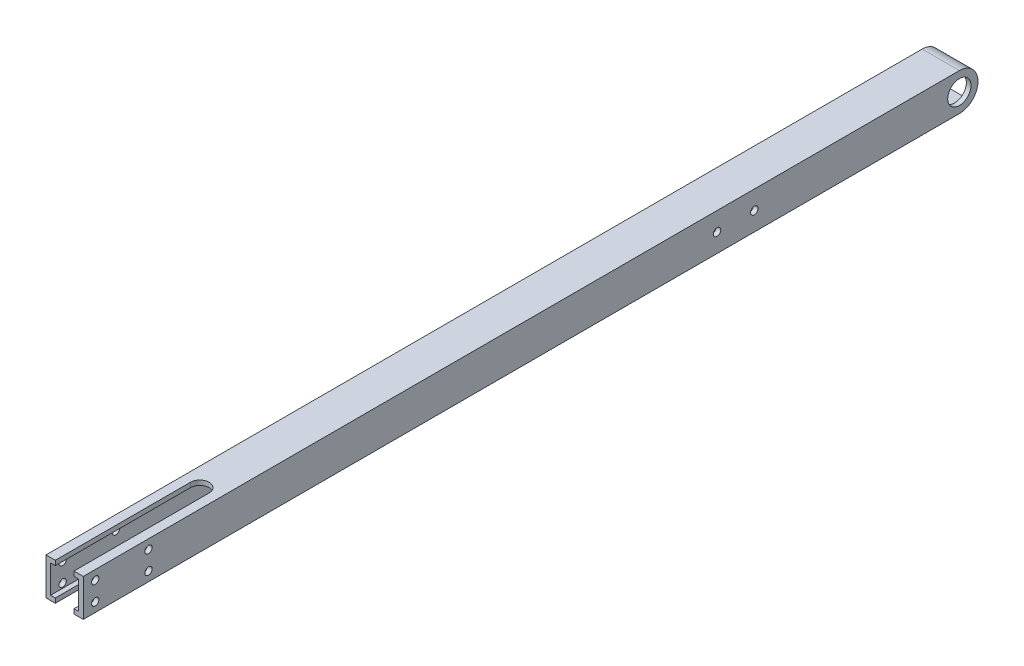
SolidWorks part; units mm, degrees
ref_plane "Front" through (0, 0, 0) normal (0, 0, 1) x (1, 0, 0)
ref_plane "Top" through (0, 0, 0) normal (0, 1, 0) x (1, 0, 0)
ref_plane "Right" through (0, 0, 0) normal (1, 0, 0) x (0, 0, -1)
sketch "Sketch1" plane through (0, 0, 0) normal (0, 0, 1) x (1, 0, 0)
  line L0 (-9.525, 9.525) -> (9.525, 9.525)
  line L1 (-12.7, -12.7) -> (12.7, -12.7)
  line L2 (-12.7, -12.7) -> (-12.7, 12.7)
  line L3 (-12.7, 12.7) -> (12.7, 12.7)
  line L4 (12.7, -12.7) -> (12.7, 12.7)
  line L5 (-12.7, -12.7) -> (12.7, 12.7) construction
  line L6 (-12.7, 12.7) -> (12.7, -12.7) construction
  line L7 (9.525, -9.525) -> (9.525, 9.525)
  line L8 (-9.525, -9.525) -> (9.525, -9.525)
  line L9 (-9.525, -9.525) -> (-9.525, 9.525)
  point P0 (0, 0)
  dimension "D1" = 25.4
  dimension "D2" = 3.175
extrude "Boss-Extrude1" add sketch "Sketch1" along normal blind 609.6
sketch "Sketch2" plane through (12.7, 0, 0) normal (1, 0, 0) x (0, 0, -1)
  line L0 (0, 0) -> (-609.6, 0) construction
  line L1 (0, -12.7) -> (0, 12.7) construction
  line L2 (-609.6, -12.7) -> (-609.6, 12.7) construction
  line L3 (-609.6, 12.7) -> (0, 12.7) construction
  line L4 (-609.6, -12.7) -> (0, -12.7) construction
  line L5 (-609.6, 12.7) -> (0, 12.7) construction
  line L6 (0, -12.7) -> (0, 12.7) construction
  line L7 (-609.6, -12.7) -> (0, -12.7) construction
  line L8 (-12.7, 12.7) -> (-12.7, -12.7) construction
  line L9 (-12.7, -12.7) -> (0, -12.7)
  line L10 (0, -12.7) -> (0, 12.7)
  line L11 (0, 12.7) -> (-12.7, 12.7)
  circle A0 centre (-12.7, 0) radius 7.9375
  arc A1 (-12.7, 12.7) -> (-12.7, -12.7) centre (-12.7, 0) cw
  dimension "D1" = 15.875
  dimension "D2" = 12.7
extrude "Cut-Extrude1" cut sketch "Sketch2" against normal through all contours A0 | A1 M2 M5 | A1 L10 M3
sketch "Sketch3" plane through (0, 12.7, 0) normal (0, 1, 0) x (1, 0, 0)
  line L1 (-6.35, -609.6) -> (6.35, -609.6)
  line L2 (-6.35, -609.6) -> (-6.35, -517.525)
  line L3 (-6.35, -517.525) -> (6.35, -517.525) construction
  line L4 (6.35, -609.6) -> (6.35, -517.525)
  line L5 (9.525, -609.6) -> (-9.525, -609.6) construction
  line L6 (6.35, -609.6) -> (-6.35, -609.6)
  line L7 (12.7, -609.6) -> (-12.7, -609.6) construction
  line L8 (-12.7, -609.6) -> (-12.7, -12.7) construction
  line L9 (12.7, -609.6) -> (12.7, -12.7) construction
  arc A0 (-6.35, -517.525) -> (6.35, -517.525) centre (0, -517.525) cw
  dimension "D1" = 92.075
  dimension "D2" = 6.35
  dimension "D3" = 6.35
extrude "Cut-Extrude2" cut sketch "Sketch3" against normal up to next contours L3 L2 L4 M6 | A0 L3
sketch "Sketch4" plane through (12.7, 0, 0) normal (1, 0, 0) x (0, 0, -1)
  line L0 (-609.6, 0) -> (0, 0) construction
  line L1 (-609.6, -12.7) -> (-609.6, 12.7) construction
  circle A0 centre (-177.8, 0) radius 2.5527
  circle A1 centre (-152.4, 0) radius 2.5527
  dimension "D2" = 5.1054
  dimension "D1" = 25.4
  dimension "D3" = 431.8
extrude "Cut-Extrude3" cut sketch "Sketch4" against normal through all
sketch "Sketch6" plane through (-12.7, 0, 0) normal (-1, 0, 0) x (0, 0, 1)
  circle A1 centre (565.15, 6.35) radius 2.4892
  circle A2 centre (565.15, 6.35) radius 2.4892
  circle A3 centre (565.15, -6.35) radius 2.4892
  circle A4 centre (565.15, -6.35) radius 2.4892
  circle A5 centre (601.4357, 6.35) radius 2.4892
  circle A6 centre (601.4357, 6.35) radius 2.4892
  circle A7 centre (601.4357, -6.35) radius 2.4892
  circle A8 centre (601.4357, -6.35) radius 2.4892
  dimension "D1" = 0
  dimension "D2" = 0
  dimension "D3" = 0
  dimension "D4" = 0
extrude "Cut-Extrude4" cut sketch "Sketch6" against normal through all
sketch "Sketch7" plane through (12.7, 0, 0) normal (1, 0, 0) x (0, 0, -1)
  line L0 (-609.6, 0) -> (0, 0) construction
  line L1 (-609.6, -12.7) -> (-609.6, 12.7) construction
  dimension "D1" = 609.6
sketch "Sketch8" plane through (0, -12.7, 0) normal (0, -1, 0) x (1, 0, 0)
  line L0 (-12.7, 609.6) -> (12.7, 609.6) construction
  line L1 (-6.35, 609.6) -> (6.35, 609.6)
  line L3 (-6.35, 609.6) -> (6.35, 609.6)
  line L4 (-6.35, 609.6) -> (-6.35, 520.7)
  line L5 (-6.35, 520.7) -> (6.35, 520.7)
  line L6 (6.35, 609.6) -> (6.35, 520.7)
  dimension "D1" = 88.9
  dimension "D2" = 12.7
extrude "Cut-Extrude5" cut sketch "Sketch8" against normal blind 3.175 contours L6 L4 L5 M6
fillet "Fillet1" radius 6.35 2 edges at (-6.35, -11.1125, 520.7) (6.35, -11.1125, 520.7)
